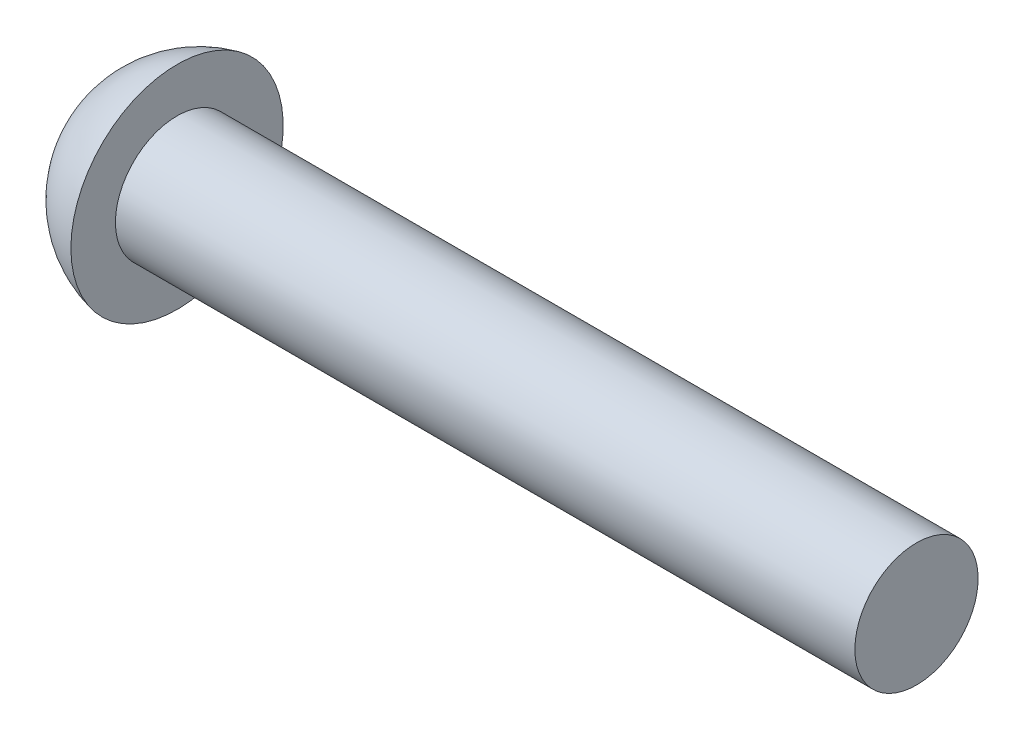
SolidWorks part; units mm, degrees
ref_plane "Plane1" through (0, 0, 0) normal (0, 0, 1) x (1, 0, 0)
ref_plane "Plane2" through (0, 0, 0) normal (0, 1, 0) x (1, 0, 0)
ref_plane "Plane3" through (0, 0, 0) normal (1, 0, 0) x (0, 0, -1)
sketch "BodySke" plane through (0, 0, 0) normal (0, 0, 1) x (1, 0, 0)
  line L0 (3.5, 2.5) -> (3.5, 4.307)
  line L1 (4.3, 15.875) -> (4.3, -8.7304) construction
  line L2 (-25.4, 0) -> (127, 0) construction
  line L3 (33.5, 0) -> (0, 0)
  line L4 (3.5, 2.5) -> (33.5, 2.5)
  line L5 (33.5, 2.5) -> (33.5, 0)
  line L8 (17.5, 0.7946) -> (17.5, -8.7304) construction
  arc A0 (3.5, 4.307) -> (0, 0) centre (4.4, 0) ccw
  dimension "Head_crown_rad" = 4.4
  dimension "Head_ht" = 3.5
  dimension "Diameter" = 5
  dimension "Length" = 30
  dimension "Head_dia" = 7.02
  dimension "Advance" = 0.8
  dimension "Thread_nom" = 16
revolve "Base-Revolve" add sketch "BodySke" angle 360 about L2
sketch "Sketch3" plane through (0, 0, 0) normal (1, 0, 0) x (0, 0, -1)
  line L0 (0.35, -2.6) -> (-0.35, -2.6)
  line L1 (0.35, -2.6) -> (0.35, 2.6)
  line L2 (-0.35, 2.6) -> (0.35, 2.6)
  line L3 (-0.35, 2.6) -> (-0.35, -2.6)
  dimension "D1" = 2.6
  dimension "Cross_dia" = 5.2
  dimension "D2" = 0.35
  dimension "Cross_width" = 0.7
ref_plane "Plane4" through (2.8, 0, 0) normal (1, 0, 0) x (0, 0, -1)
sketch "Sketch4" plane through (2.8, 0, 0) normal (1, 0, 0) x (0, 0, -1)
  line L0 (0.35, -1.204) -> (-0.35, -1.204)
  line L1 (0.35, -1.204) -> (0.35, 1.204)
  line L2 (-0.35, 1.204) -> (0.35, 1.204)
  line L3 (-0.35, 1.204) -> (-0.35, -1.204)
  dimension "D1" = 0.7
  dimension "D2" = 2.4079
  dimension "D3" = 0.35
  dimension "D4" = 1.204
loft "Recess" cut profiles "Sketch3", "Sketch4"
pattern_circular "RecPat" count 2 every 90 about axis through (0, 0, 0) along (1, 0, 0) of "Recess"
sketch "RecCorSke" plane through (0, 0, 0) normal (0, 0, 1) x (1, 0, 0)
  line L0 (-3.175, 0) -> (15.875, 0) construction
  line L1 (-25.4, 0) -> (127, 0) construction
  line L2 (0, 0) -> (0, 1.0468)
  line L3 (0, 1.0468) -> (2.8, 0.851)
  line L4 (2.8, 0.851) -> (3.0765, 0)
  line L5 (3.0765, 0) -> (0, 0)
  dimension "Diameter" = 1.702
  dimension "Depth" = 2.8
  dimension "Draft_angle" = 4
  dimension "Bottom_angle" = 18
revolve "RecessCore" cut sketch "RecCorSke" angle 360 about L0
sketch "Sketch5" plane through (0, 0, 0) normal (1, 0, 0) x (0, 0, -1)
  line L0 (-0.7, -4.2497) -> (-0.7, 4.2497)
  line L1 (0, 4.307) -> (0, -4.307) construction
  line L2 (0.7, -4.2497) -> (0.7, 4.2497)
  circle A0 centre (0, 0) radius 4.307 construction
  arc A1 (0.7, 4.2497) -> (-0.7, 4.2497) centre (0, 0) ccw
  arc A2 (-0.7, -4.2497) -> (0.7, -4.2497) centre (0, 0) ccw
  dimension "Slot_width" = 1.4
extrude "Slot" [suppressed] cut sketch "Sketch5" along normal blind 2.3
equation "\"D1@Sketch3\" = \"Cross_dia@Sketch3\" / 2"
equation "\"D2@Sketch3\" = \"Cross_width@Sketch3\" / 2"
equation "\"Depth@RecCorSke\" = \"Cross_depth@Plane4\""
equation "\"D1@Sketch4\" = \"Cross_width@Sketch3\""
equation "\"D2@Sketch4\" = \"Cross_dia@Sketch3\" - 2.0 * \"Cross_depth@Plane4\" * tan(26.5  * 0.017453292)"
equation "\"D3@Sketch4\" = \"D1@Sketch4\" / 2"
equation "\"D4@Sketch4\" = \"D2@Sketch4\" / 2"
equation "\"Thread_length@ThreadCosmetic\" = ((sgn( (\"Length@BodySke\" - \"Advance@BodySke\" * 2.0 ) - \"Thread_nom@BodySke\" )-1)*( (\"Length@BodySke\" - \"Advance@BodySke\" * 2.0 ) - \"Thread_nom@BodySke\" ))/-2+ \"Thread_"
